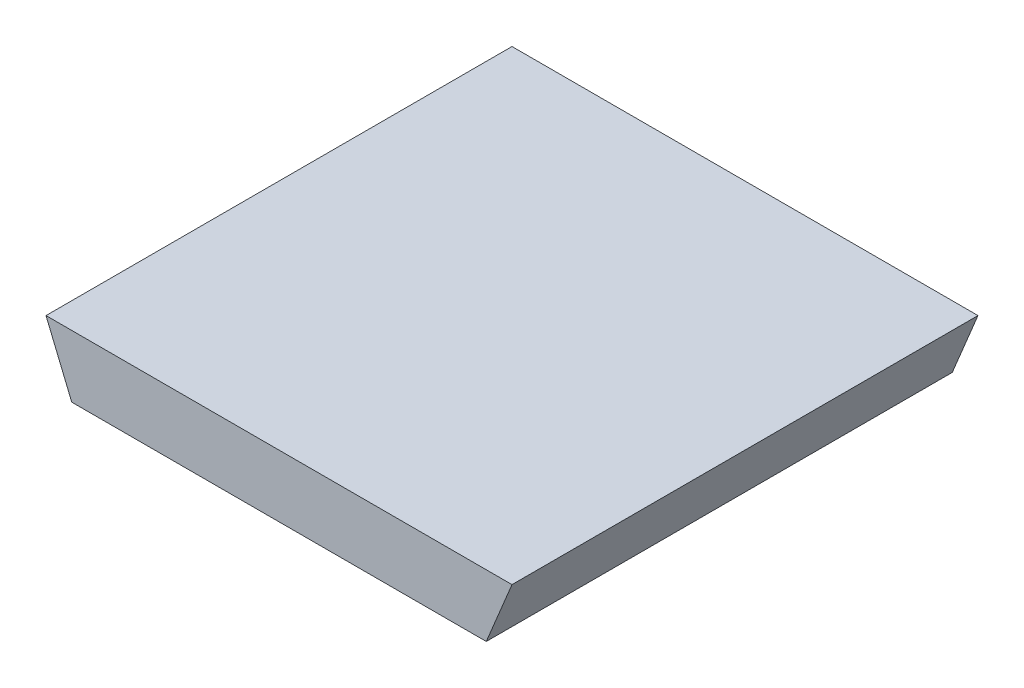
SolidWorks part; units mm, degrees
ref_plane "Vorderansicht-XY" through (0, 0, 0) normal (0, 0, 1) x (1, 0, 0)
ref_plane "Draufsicht-ZX" through (0, 0, 0) normal (0, 1, 0) x (1, 0, 0)
ref_plane "Seitenansicht-YZ" through (0, 0, 0) normal (1, 0, 0) x (0, 0, -1)
sketch "Skizze1" plane through (0, 0, 0) normal (0, 0, 1) x (1, 0, 0)
  line L0 (-15, 0) -> (15, 0)
  line L1 (94.5547, 0) -> (-94.5547, 0) construction
  line L2 (15, 0) -> (13.3431, -4)
  line L3 (13.3431, -4) -> (-13.3431, -4)
  line L4 (-13.3431, -4) -> (-15, 0)
  line L5 (-13.3431, -4) -> (0, -36.2132) construction
  line L6 (0, -36.2132) -> (13.3431, -4) construction
  point P6 (0, 0)
  dimension "D1" = 30
  dimension "D2" = 4
  dimension "D3" = 45
  dimension "D4" = 36.2132
extrude "Aufsatz-Linear austragen1" add sketch "Skizze1" along normal mid plane 30
